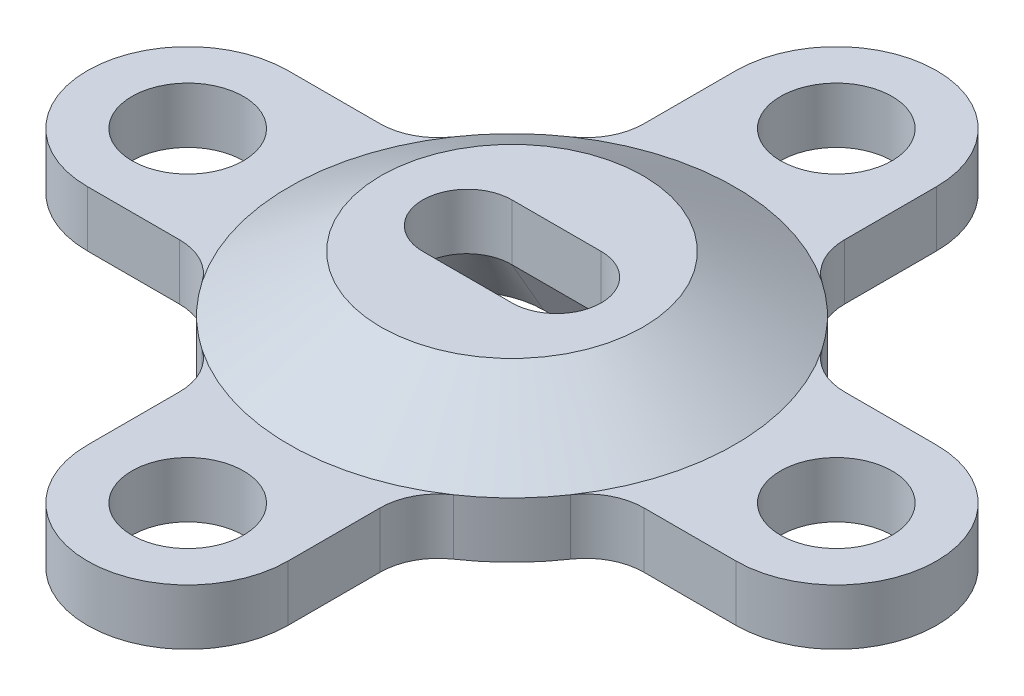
SolidWorks part; units mm, degrees
ref_plane "Front Plane" through (0, 0, 0) normal (0, 0, 1) x (1, 0, 0)
ref_plane "Top Plane" through (0, 0, 0) normal (0, 1, 0) x (1, 0, 0)
ref_plane "Right Plane" through (0, 0, 0) normal (1, 0, 0) x (0, 0, -1)
sketch "Sketch1" plane through (0, 0, 0) normal (0, 0, 1) x (1, 0, 0)
  line L0 (-12.7, 0) -> (-12.7, 3.175)
  line L1 (55, 0) -> (-55, 0) construction
  line L2 (-12.7, 3.175) -> (-7.4657, 6.35)
  line L3 (-7.4657, 6.35) -> (0, 6.35)
  line L4 (0, -55) -> (0, 55) construction
  line L5 (0, 0) -> (0, -9.9414) construction
  line L6 (-12.7, 0) -> (0, 0)
  line L7 (0, 0) -> (0, 6.35)
  dimension "D1" = 12.7
  dimension "D2" = 3.175
  dimension "D3" = 3.175
revolve "Revolve1" add sketch "Sketch1" angle 360 about L5
sketch "Sketch2" plane through (0, 6.35, 0) normal (0, 1, 0) x (1, 0, 0)
  line L0 (-2.54, 0) -> (2.54, 0) construction
  line L1 (-55, 0) -> (55, 0) construction
  line L2 (-2.54, 2.54) -> (2.54, 2.54)
  line L3 (-2.54, -2.54) -> (2.54, -2.54)
  line L4 (-5.08, 0) -> (-5.08, 6.4545) construction
  line L5 (5.08, 0) -> (5.08, 7.3766) construction
  arc A0 (-2.54, 2.54) -> (-2.54, -2.54) centre (-2.54, 0) ccw
  arc A1 (2.54, -2.54) -> (2.54, 2.54) centre (2.54, 0) ccw
  point P5 (0, 0)
  dimension "D1" = 5.08
  dimension "D2" = 10.16
extrude "Cut-Extrude1" cut sketch "Sketch2" against normal blind 15.748
sketch "Sketch3" plane through (0, 0, 0) normal (0, 1, 0) x (1, 0, 0)
  line L0 (0, -3.4925) -> (0, 3.4925) construction
  line L1 (-5.715, 18.463) -> (-5.715, 7.9157)
  line L2 (5.715, 18.463) -> (5.715, 7.9157)
  line L3 (-5.715, 7.9157) -> (5.715, 7.9157)
  line L4 (18.463, 5.715) -> (7.9157, 5.715)
  line L5 (18.463, -5.715) -> (7.9157, -5.715)
  line L6 (7.9157, 5.715) -> (7.9157, -5.715)
  line L7 (5.715, -18.463) -> (5.715, -7.9157)
  line L8 (-5.715, -18.463) -> (-5.715, -7.9157)
  line L9 (5.715, -7.9157) -> (-5.715, -7.9157)
  line L10 (-18.463, -5.715) -> (-7.9157, -5.715)
  line L11 (-18.463, 5.715) -> (-7.9157, 5.715)
  line L12 (-7.9157, -5.715) -> (-7.9157, 5.715)
  circle A0 centre (0, 18.463) radius 3.175
  arc A1 (5.715, 18.463) -> (-5.715, 18.463) centre (0, 18.463) ccw
  circle A2 centre (18.463, 0) radius 3.175
  arc A3 (18.463, -5.715) -> (18.463, 5.715) centre (18.463, 0) ccw
  circle A4 centre (0, -18.463) radius 3.175
  arc A5 (-5.715, -18.463) -> (5.715, -18.463) centre (0, -18.463) ccw
  circle A6 centre (-18.463, 0) radius 3.175
  arc A7 (-18.463, 5.715) -> (-18.463, -5.715) centre (-18.463, 0) ccw
  point P29 (0, 0)
  dimension "D1" = 6.35
  dimension "D2" = 2.54
  dimension "D3" = 4
extrude "Boss-Extrude1" add sketch "Sketch3" along normal blind 3.175
fillet "Fillet1" radius 3.302 8 edges at (11.3415, 1.5875, -5.715) (5.715, 1.5875, -11.3415) (-5.715, 1.5875, -11.3415) (-11.3415, 1.5875, -5.715) (-11.3415, 1.5875, 5.715) (-5.715, 1.5875, 11.3415) (5.715, 1.5875, 11.3415) (11.3415, 1.5875, 5.715)
sketch "Sketch4" plane through (0, 3.175, 0) normal (0, 1, 0) x (1, 0, 0)
  circle A0 centre (0, -18.463) radius 4.7625
  dimension "D1" = 9.525
sketch "Sketch5" plane through (0, 0, 0) normal (0, -1, 0) x (1, 0, 0)
  line L0 (-2.5556, 0) -> (2.5556, 0) construction
  line L1 (3.4925, 0) -> (-3.4925, 0) construction
  line L2 (-2.5556, 4.3608) -> (2.5556, 4.3608)
  line L3 (-2.5556, -4.3608) -> (2.5556, -4.3608)
  arc A0 (-2.5556, 4.3608) -> (-2.5556, -4.3608) centre (-2.5556, 0) ccw
  arc A1 (2.5556, -4.3608) -> (2.5556, 4.3608) centre (2.5556, 0) ccw
  point P5 (0, 0)
extrude "Cut-Extrude2" cut sketch "Sketch5" against normal blind 3.175 draft 30
